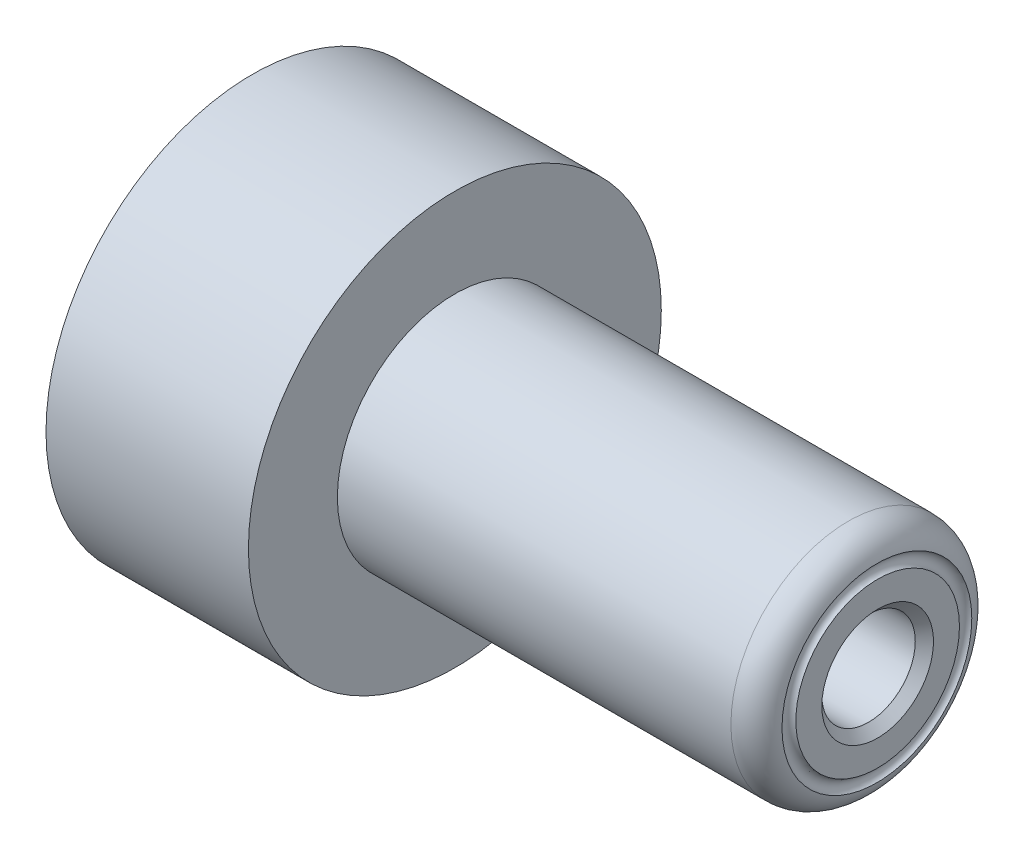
SolidWorks part; units mm, degrees
ref_plane "Front Plane" through (0, 0, 0) normal (0, 0, 1) x (1, 0, 0)
ref_plane "Top Plane" through (0, 0, 0) normal (0, 1, 0) x (1, 0, 0)
ref_plane "Right Plane" through (0, 0, 0) normal (1, 0, 0) x (0, 0, -1)
sketch "Sketch1" plane through (0, 0, 0) normal (0, 0, 1) x (1, 0, 0)
  line L0 (0, 0) -> (102.3864, 0) construction
  line L1 (0, 3.9751) -> (0, 11.1125)
  line L2 (0, 11.1125) -> (10.8966, 11.1125)
  line L3 (10.8966, 11.1125) -> (10.8966, 6.3246)
  line L4 (10.8966, 6.3246) -> (32.0802, 6.3246)
  line L5 (33.655, 4.7498) -> (33.655, 0)
  line L6 (33.655, 0) -> (21.8948, 0)
  line L7 (0, 3.9751) -> (21.8948, 3.9751)
  line L8 (21.8948, 3.9751) -> (21.8948, 0)
  arc A0 (33.655, 4.7498) -> (32.0802, 6.3246) centre (32.0802, 4.7498) ccw
  dimension "D5" = 1.5748
  dimension "D1" = 10.8966
  dimension "D2" = 22.225
  dimension "D3" = 21.8948
  dimension "D4" = 7.9502
  dimension "D6" = 33.655
  dimension "D7" = 12.6492
revolve "Revolve1" add sketch "Sketch1" angle 360 about L0
sketch "Sketch2" plane through (0, 0, 0) normal (-1, 0, 0) x (0, 0, 1)
  line L0 (0, 0) -> (0, 9.7644) construction
  circle A0 centre (-6.7437, 0) radius 1.2065
  circle A1 centre (6.7437, 0) radius 1.2065
  dimension "D2" = 2.413
  dimension "D1" = 13.4874
extrude "Cut-Extrude1" cut sketch "Sketch2" against normal blind 2.54
sketch "Sketch3" plane through (33.655, 0, 0) normal (1, 0, 0) x (0, 0, -1)
  circle A0 centre (0, 0) radius 2.515
  dimension "D1" = 5.03
extrude "Cut-Extrude2" cut sketch "Sketch3" against normal through all
chamfer "Chamfer1" distance 0.49 angle 45 1 edges at (33.655, 0, -2.515)
sketch "Sketch4" plane through (0, 0, 0) normal (0, 0, 1) x (1, 0, 0)
  line L0 (0, 0) -> (36.002, 0) construction
  line L3 (33.655, -4.7498) -> (33.655, 4.7498) construction
  circle A0 centre (33.778, 4.765) radius 0.381
  dimension "D1" = 9.53
  dimension "D2" = 0.123
  dimension "D3" = 0.381
revolve "Cut-Revolve1" cut sketch "Sketch4" angle 360 about L0
